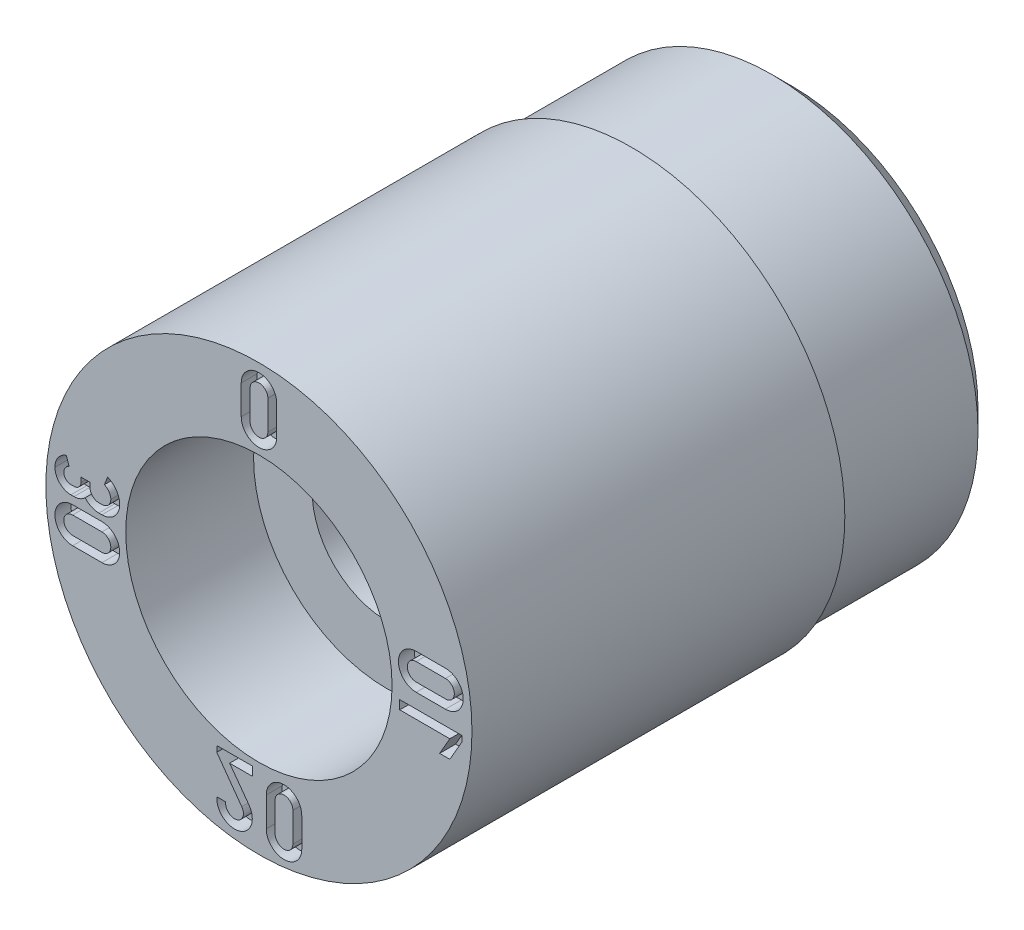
SolidWorks part; units mm, degrees
ref_plane "Front Plane" through (0, 0, 0) normal (0, 0, 1) x (1, 0, 0)
ref_plane "Top Plane" through (0, 0, 0) normal (0, 1, 0) x (1, 0, 0)
ref_plane "Right Plane" through (0, 0, 0) normal (1, 0, 0) x (0, 0, -1)
sketch "Sketch1" plane through (0, 0, 0) normal (1, 0, 0) x (0, 0, -1)
  line L2 (0, 2) -> (0, 1.25)
  line L3 (4.75, 2) -> (0, 2)
  line L4 (-3.7979, 0) -> (49996.2021, 0) construction
  line L8 (5, 0.7) -> (1.2, 0.7)
  line L9 (1.2, 1.25) -> (1.2, 0.7)
  line L10 (1.2, 1.25) -> (0, 1.25)
  line L12 (5, 0.7) -> (5, 1.75)
  line L16 (5, 1.75) -> (4.75, 2)
  dimension "D1" = 5
  dimension "D2" = 45
  dimension "D3" = 0.25
  dimension "D4" = 4
  dimension "D5" = 2.5
  dimension "D6" = 1.2
  dimension "D7" = 1.4
revolve "Revolve1" add sketch "Sketch1" angle 360 about L4
sketch "Sketch5" plane through (0, 0, 0) normal (1, 0, 0) x (0, 0, -1)
  line L0 (0, 0) -> (50000, 0) construction
  line L1 (0, 2) -> (0, -2) construction
  line L2 (3.5, 1.935) -> (5, 1.935)
  line L3 (3.5, 1.935) -> (3.5, 2.935)
  line L4 (3.5, 2.935) -> (5, 2.935)
  line L5 (5, 1.935) -> (5, 2.935)
  line L6 (5, -1.75) -> (5, 1.75) construction
  line L7 (4.75, 2) -> (0, 2) construction
  dimension "D1" = 3.5
  dimension "D2" = 0.065
  dimension "D3" = 1
revolve "Cut-Revolve1" cut sketch "Sketch5" angle 360 about L0
sketch "Sketch2" plane through (0, 0, 0) normal (0, 0, 1) x (1, 0, 0)
  line L115 (-1.7485, -0.0295) -> (-1.4736, -0.0296)
  line L116 (-1.4736, -0.3629) -> (-1.7485, -0.3628)
  line L117 (-1.4736, -0.2796) -> (-1.7485, -0.2795)
  line L118 (-1.7485, -0.1129) -> (-1.4736, -0.1129)
  line L119 (0.0841, 1.4773) -> (0.084, 1.7522)
  line L120 (-0.0826, 1.7522) -> (-0.0826, 1.4773)
  line L121 (-0.1659, 1.7522) -> (-0.1659, 1.4773)
  line L122 (0.1674, 1.4773) -> (0.1674, 1.7522)
  line L123 (-0.0622, -1.3936) -> (-0.0622, -1.3102)
  line L124 (-0.0622, -1.3102) -> (-0.3954, -1.3103)
  line L125 (-0.3954, -1.3103) -> (-0.3954, -1.3654)
  line L126 (-0.3954, -1.3654) -> (-0.1611, -1.6906)
  line L127 (-0.3111, -1.7268) -> (-0.3949, -1.7268)
  line L128 (-0.0934, -1.6418) -> (-0.2746, -1.3936)
  line L129 (-0.2746, -1.3936) -> (-0.0622, -1.3936)
  line L130 (1.9047, -0.0785) -> (1.9047, -0.1333)
  line L131 (1.9047, -0.1333) -> (1.7926, -0.3284)
  line L132 (1.7926, -0.3284) -> (1.6965, -0.3284)
  line L133 (1.6965, -0.3284) -> (1.7923, -0.1618)
  line L134 (1.7923, -0.1618) -> (1.3216, -0.1618)
  line L135 (1.3216, -0.1618) -> (1.3216, -0.0785)
  line L136 (1.3216, -0.0785) -> (1.9047, -0.0785)
  line L137 (1.4763, 0.1414) -> (1.7512, 0.1414)
  line L138 (1.7512, 0.308) -> (1.4762, 0.308)
  line L139 (1.7512, 0.3913) -> (1.4762, 0.3913)
  line L140 (1.4763, 0.0581) -> (1.7512, 0.0581)
  line L141 (-1.4734, 0.1094) -> (-1.5025, 0.1094)
  line L142 (-1.5858, 0.1927) -> (-1.5858, 0.2343)
  line L143 (-1.5858, 0.2343) -> (-1.6691, 0.2343)
  line L144 (-1.6691, 0.2343) -> (-1.6691, 0.1927)
  line L145 (-1.7358, 0.1261) -> (-1.7649, 0.1261)
  line L146 (-1.7806, 0.2637) -> (-1.8072, 0.3427)
  line L147 (-1.7649, 0.0427) -> (-1.7358, 0.0427)
  line L148 (-1.5025, 0.0261) -> (-1.4734, 0.0261)
  line L149 (-1.4201, 0.3593) -> (-1.4507, 0.2818)
  line L150 (0.4022, -1.755) -> (0.4023, -1.4801)
  line L151 (0.069, -1.4801) -> (0.069, -1.7551)
  line L152 (0.1523, -1.4801) -> (0.1523, -1.7551)
  line L153 (0.3189, -1.7551) -> (0.3189, -1.4801)
  arc A54 (-1.4736, -0.3629) -> (-1.4736, -0.0296) centre (-1.4736, -0.1962) ccw
  arc A55 (-1.7485, -0.0295) -> (-1.7485, -0.3628) centre (-1.7485, -0.1962) ccw
  arc A56 (-1.4736, -0.2796) -> (-1.4736, -0.1129) centre (-1.4736, -0.1962) ccw
  arc A57 (-1.7485, -0.1129) -> (-1.7485, -0.2795) centre (-1.7485, -0.1962) ccw
  arc A58 (-0.0826, 1.4773) -> (0.0841, 1.4773) centre (0.0007, 1.4773) ccw
  arc A59 (0.084, 1.7522) -> (-0.0826, 1.7522) centre (0.0007, 1.7522) ccw
  arc A60 (-0.1659, 1.4773) -> (0.1674, 1.4773) centre (0.0007, 1.4773) ccw
  arc A61 (0.1674, 1.7522) -> (-0.1659, 1.7522) centre (0.0007, 1.7522) ccw
  arc A62 (-0.3111, -1.7268) -> (-0.1611, -1.6906) centre (-0.2287, -1.7393) ccw
  arc A63 (-0.3949, -1.7268) -> (-0.0934, -1.6418) centre (-0.2287, -1.7392) ccw
  arc A64 (1.4762, 0.308) -> (1.4763, 0.1414) centre (1.4763, 0.2247) ccw
  arc A65 (1.7512, 0.1414) -> (1.7512, 0.308) centre (1.7512, 0.2247) ccw
  arc A66 (1.4762, 0.3913) -> (1.4763, 0.0581) centre (1.4763, 0.2247) ccw
  arc A67 (1.7512, 0.0581) -> (1.7512, 0.3913) centre (1.7512, 0.2247) ccw
  arc A68 (-1.39, 0.1927) -> (-1.4507, 0.2818) centre (-1.4859, 0.1927) ccw
  arc A69 (-1.4734, 0.1094) -> (-1.39, 0.1927) centre (-1.4734, 0.1927) ccw
  arc A70 (-1.5858, 0.1927) -> (-1.5025, 0.1094) centre (-1.5025, 0.1927) ccw
  arc A71 (-1.7358, 0.1261) -> (-1.6691, 0.1927) centre (-1.7358, 0.1927) ccw
  arc A72 (-1.8316, 0.1927) -> (-1.7649, 0.1261) centre (-1.7649, 0.1928) ccw
  arc A73 (-1.7806, 0.2637) -> (-1.8316, 0.1927) centre (-1.7567, 0.1928) ccw
  arc A74 (-1.8072, 0.3427) -> (-1.9149, 0.1927) centre (-1.7565, 0.1927) ccw
  arc A75 (-1.9149, 0.1927) -> (-1.7649, 0.0427) centre (-1.7649, 0.1927) ccw
  arc A76 (-1.7358, 0.0427) -> (-1.6305, 0.086) centre (-1.7358, 0.1926) ccw
  arc A77 (-1.6305, 0.086) -> (-1.5025, 0.0261) centre (-1.5025, 0.1926) ccw
  arc A78 (-1.4734, 0.0261) -> (-1.3068, 0.1927) centre (-1.4733, 0.1927) ccw
  arc A79 (-1.3068, 0.1927) -> (-1.4201, 0.3593) centre (-1.4859, 0.1927) ccw
  arc A80 (0.4023, -1.4801) -> (0.069, -1.4801) centre (0.2356, -1.4801) ccw
  arc A81 (0.069, -1.7551) -> (0.4022, -1.755) centre (0.2356, -1.7551) ccw
  arc A82 (0.3189, -1.4801) -> (0.1523, -1.4801) centre (0.2356, -1.4801) ccw
  arc A83 (0.1523, -1.7551) -> (0.3189, -1.7551) centre (0.2356, -1.7551) ccw
  point P224 (0, 0.0034)
  point P225 (0.0034, 0.0034)
  point P226 (0.0034, 0)
extrude "Cut-Extrude1" cut sketch "Sketch2" against normal blind 0.15
